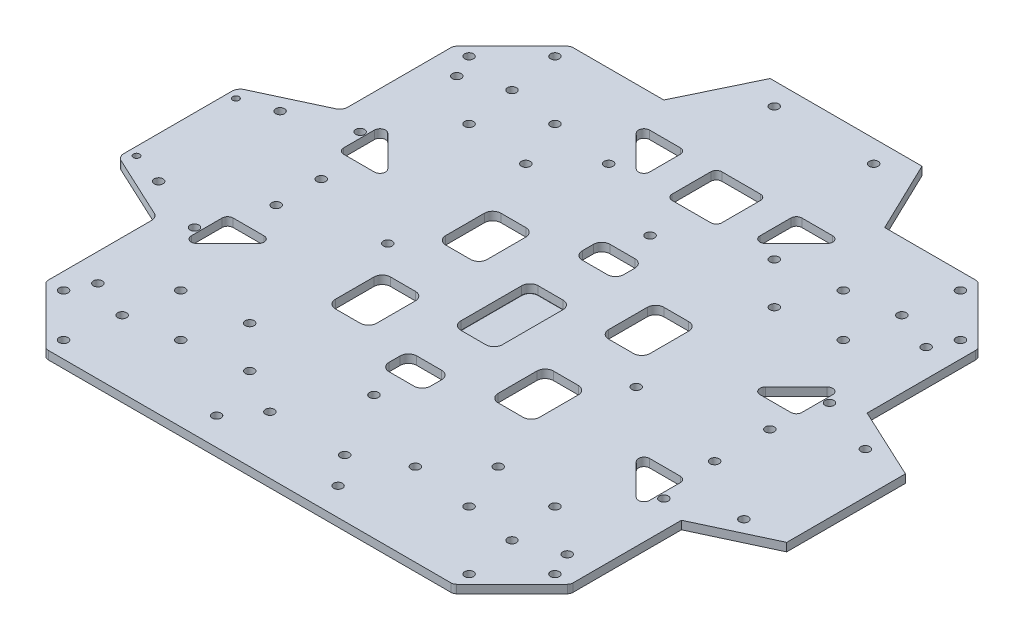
SolidWorks part; units mm, degrees
ref_plane "前视基准面" through (0, 0, 0) normal (0, 0, 1) x (1, 0, 0)
ref_plane "上视基准面" through (0, 0, 0) normal (0, 1, 0) x (1, 0, 0)
ref_plane "右视基准面" through (0, 0, 0) normal (1, 0, 0) x (0, 0, -1)
other "Configuration Table"
sketch "草图1" plane through (0, 0, 0) normal (0, 1, 0) x (1, 0, 0)
  line L0 (0, 0) -> (0, 165.603) construction
  line L1 (95, -73.7868) -> (95, 73.7868)
  line L2 (95, 73.7868) -> (73.7868, 95)
  line L3 (73.7868, 95) -> (-73.7868, 95)
  line L4 (-73.7868, 95) -> (-95, 73.7868)
  line L5 (-95, 73.7868) -> (-95, -73.7868)
  line L6 (-95, -73.7868) -> (-73.7868, -95)
  line L7 (-73.7868, -95) -> (73.7868, -95)
  line L8 (73.7868, -95) -> (95, -73.7868)
  line L9 (0, 0) -> (213.7391, 0) construction
  line L10 (-88.9896, -73.4332) -> (-52.22, -67.7764) construction
  line L11 (-73.4332, -88.9896) -> (-67.7764, -52.22) construction
  circle A0 centre (-88.9896, -73.4332) radius 1.6
  circle A1 centre (-73.4332, -88.9896) radius 1.6
  circle A2 centre (-73.4332, 88.9896) radius 1.6
  circle A3 centre (-88.9896, 73.4332) radius 1.6
  circle A4 centre (73.4332, 88.9896) radius 1.6
  circle A5 centre (88.9896, 73.4332) radius 1.6
  circle A6 centre (88.9896, -73.4332) radius 1.6
  circle A7 centre (73.4332, -88.9896) radius 1.6
  circle A9 centre (-67.7764, -52.22) radius 1.6
  circle A10 centre (-52.22, -67.7764) radius 1.6
  circle A11 centre (67.7764, -52.22) radius 1.6
  circle A12 centre (52.22, -67.7764) radius 1.6
  circle A13 centre (67.7764, 52.22) radius 1.6
  circle A14 centre (52.22, 67.7764) radius 1.6
  circle A15 centre (-67.7764, 52.22) radius 1.6
  circle A16 centre (-52.22, 67.7764) radius 1.6
  circle A17 centre (-70.6048, -70.6048) radius 1.6
  circle A18 centre (-70.6048, 70.6048) radius 1.6
  circle A19 centre (70.6048, -70.6048) radius 1.6
  circle A20 centre (70.6048, 70.6048) radius 1.6
  dimension "D5" = 3.2
  dimension "D6" = 3.2
  dimension "D7" = 3.2
  dimension "D1" = 190
  dimension "D2" = 190
  dimension "D3" = 30
  dimension "D4" = 135
extrude "凸台-拉伸1" add sketch "草图1" along normal blind 3 contours L8 A7 A6 L1 L2 A5 A4 L3 L4 A2 A3 L5 L6 A0 A1 L7 A15 A14 A13 A11 A10 A9 A12 A16
fillet "圆角1" radius 2 8 edges at (95, 1.5, -73.7868) (95, 1.5, 73.7868) (73.7868, 1.5, 95) (-73.7868, 1.5, 95) (-95, 1.5, -73.7868) (-73.7868, 1.5, -95) (73.7868, 1.5, -95) (-95, 1.5, 73.7868)
sketch "草图2" plane through (0, 3, 0) normal (0, 1, 0) x (1, 0, 0)
  line L0 (0, 95) -> (0, -95) construction
  line L1 (72.9584, 95) -> (-72.9584, 95) construction
  line L2 (-72.9584, -95) -> (72.9584, -95) construction
  line L3 (-20, -65) -> (-38, -83) construction
  line L4 (-38, -83) -> (-20, -83) construction
  line L5 (-20, -83) -> (-20, -65) construction
  line L6 (38, -83) -> (20, -83) construction
  line L7 (20, -65) -> (38, -83) construction
  line L8 (20, -83) -> (20, -65) construction
  line L9 (-65, 20) -> (-83, 38)
  line L10 (-9, -83) -> (9, -83) construction
  line L11 (-9, -83) -> (-9, -65) construction
  line L12 (-9, -65) -> (9, -65) construction
  line L13 (9, -83) -> (9, -65) construction
  line L14 (-83, 38) -> (-83, 20)
  line L15 (-83, 20) -> (-65, 20)
  line L16 (-83, -38) -> (-83, -20)
  line L17 (-65, -20) -> (-83, -38)
  line L18 (-83, -20) -> (-65, -20)
  line L19 (-83, 9) -> (-83, -9) construction
  line L20 (-83, 9) -> (-65, 9) construction
  line L21 (-65, 9) -> (-65, -9) construction
  line L22 (-83, -9) -> (-65, -9) construction
  line L23 (20, 65) -> (38, 83)
  line L24 (38, 83) -> (20, 83)
  line L25 (20, 83) -> (20, 65)
  line L26 (-38, 83) -> (-20, 83)
  line L27 (-20, 65) -> (-38, 83)
  line L28 (-20, 83) -> (-20, 65)
  line L29 (9, 83) -> (-9, 83)
  line L30 (9, 83) -> (9, 65)
  line L31 (9, 65) -> (-9, 65)
  line L32 (-9, 83) -> (-9, 65)
  line L33 (65, -20) -> (83, -38)
  line L34 (83, -38) -> (83, -20)
  line L35 (83, -20) -> (65, -20)
  line L36 (83, 38) -> (83, 20)
  line L37 (65, 20) -> (83, 38)
  line L38 (83, 20) -> (65, 20)
  line L39 (83, -9) -> (83, 9) construction
  line L40 (83, -9) -> (65, -9) construction
  line L41 (65, -9) -> (65, 9) construction
  line L42 (83, 9) -> (65, 9) construction
  point P49 (0, 0)
  dimension "D1" = 20
  dimension "D2" = 18
  dimension "D3" = 12
  dimension "D4" = 11
  dimension "D5" = 4
extrude "切除-拉伸1" cut sketch "草图2" against normal through all
fillet "圆角2" radius 2 22 edges at (38, 1.5, -83) (20, 1.5, -65) (20, 1.5, -83) (-20, 1.5, -83) (-20, 1.5, -65) (-38, 1.5, -83) (-9, 1.5, -65) (-9, 1.5, -83) (9, 1.5, -83) (9, 1.5, -65) (-83, 1.5, 20) (-65, 1.5, 20) (-83, 1.5, -38) (-65, 1.5, -20) (-83, 1.5, -20) (83, 1.5, -20) (65, 1.5, -20) (83, 1.5, -38) (83, 1.5, 38) (65, 1.5, 20) (83, 1.5, 20) (-83, 1.5, 38)
sketch "草图4" plane through (0, 3, 0) normal (0, 1, 0) x (1, 0, 0)
  line L0 (0, 0) -> (0, 123) construction
  line L1 (72.9584, 95) -> (-72.9584, 95) construction
  line L2 (-21.5, 121) -> (-33.624, 95) construction
  line L3 (-21.5, 95) -> (21.5, 95) construction
  line L5 (-21.5, 121) -> (21.5, 121) construction
  line L7 (-33.624, 95) -> (-21.5, 95) construction
  line L8 (21.5, 121) -> (33.624, 95) construction
  line L9 (33.624, 95) -> (21.5, 95) construction
  line L16 (21.5, -121) -> (33.624, -95) construction
  line L17 (21.5, -95) -> (-21.5, -95) construction
  line L18 (21.5, -121) -> (-21.5, -121) construction
  line L19 (33.624, -95) -> (21.5, -95) construction
  line L20 (-21.5, -121) -> (-33.624, -95) construction
  line L21 (-33.624, -95) -> (-21.5, -95) construction
  line L22 (-121, -21.5) -> (-95, -33.624)
  line L23 (-95, -21.5) -> (-95, 21.5)
  line L24 (-121, -21.5) -> (-121, 21.5)
  line L25 (-95, -33.624) -> (-95, -21.5)
  line L26 (-121, 21.5) -> (-95, 33.624)
  line L27 (-95, 33.624) -> (-95, 21.5)
  line L28 (121, 21.5) -> (95, 33.624)
  line L29 (95, 21.5) -> (95, -21.5)
  line L30 (121, 21.5) -> (121, -21.5)
  line L31 (95, 33.624) -> (95, 21.5)
  line L32 (121, -21.5) -> (95, -33.624)
  line L33 (95, -33.624) -> (95, -21.5)
  line L34 (95, 33.624) -> (95, 21.5)
  line L36 (121, 21.5) -> (95, 33.624)
  line L37 (95, -33.624) -> (95, -21.5)
  line L38 (121, -21.5) -> (121, 21.5)
  line L39 (95, -21.5) -> (95, 21.5)
  line L40 (121, -21.5) -> (95, -33.624)
  point P32 (0, 0)
  dimension "D1" = 28
  dimension "D2" = 43
  dimension "D3" = 26
  dimension "D4" = 65
  dimension "D5" = 26
  dimension "D6" = 4
extrude "凸台-拉伸2" add sketch "草图4" against normal up to surface (3 mm away)
fillet "圆角3" radius 3 4 edges at (-121, 1.5, -21.5) (-121, 1.5, 21.5) (-95, 1.5, 33.624) (-95, 1.5, -33.624)
sketch "草图5" plane through (0, 0, 0) normal (0, -1, 0) x (1, 0, 0)
  line L0 (0, -121) -> (0, 0) construction
  line L3 (-21, -121) -> (21, -121) construction
  line L4 (-21, -121) -> (-21, -79) construction
  line L5 (-21, -79) -> (21, -79) construction
  line L6 (21, -121) -> (21, -79) construction
  line L46 (77.5, 0) -> (-77.5, 0) construction
  line L47 (-37, -10) -> (-22, -10)
  line L48 (-77.25, 8.16) -> (-46.75, 8.16) construction
  line L65 (-77.25, 8.16) -> (-77.25, -8.16) construction
  line L66 (-77.25, -8.16) -> (-46.75, -8.16) construction
  line L67 (-46.75, 8.16) -> (-46.75, -8.16) construction
  line L68 (-7.5, -14) -> (7.5, -14)
  line L69 (-62, 9) -> (-62, -9) construction
  line L71 (72.9584, -95) -> (-72.9584, -95) construction
  line L72 (-7.5, -14) -> (-7.5, 14)
  line L73 (-7.5, 14) -> (7.5, 14)
  line L74 (7.5, -14) -> (7.5, 14)
  line L75 (-7.5, -14) -> (7.5, 14) construction
  line L76 (-7.5, 14) -> (7.5, -14) construction
  line L77 (-37, 30) -> (-22, 30)
  line L78 (-37, 30) -> (-37, 10)
  line L79 (-37, 10) -> (-22, 10)
  line L80 (-22, 30) -> (-22, 10)
  line L81 (-22, -30) -> (-22, -10)
  line L82 (-37, -30) -> (-22, -30)
  line L83 (-37, -30) -> (-37, -10)
  line L84 (37, 10) -> (22, 10)
  line L85 (22, 30) -> (22, 10)
  line L86 (37, 30) -> (22, 30)
  line L87 (37, 30) -> (37, 10)
  line L88 (37, -30) -> (37, -10)
  line L89 (37, -30) -> (22, -30)
  line L90 (22, -30) -> (22, -10)
  line L91 (37, -10) -> (22, -10)
  line L92 (-7.5, -40) -> (7.5, -40)
  line L93 (-7.5, 30) -> (7.5, 30)
  line L94 (-7.5, 30) -> (-7.5, 40)
  line L95 (-7.5, 40) -> (7.5, 40)
  line L96 (7.5, 30) -> (7.5, 40)
  line L97 (-7.5, 30) -> (7.5, 40) construction
  line L98 (-7.5, 40) -> (7.5, 30) construction
  line L99 (7.5, -30) -> (7.5, -40)
  line L100 (-7.5, -30) -> (7.5, -30)
  line L101 (-7.5, -30) -> (-7.5, -40)
  line L102 (0, 95) -> (0, 52.1919) construction
  line L103 (-72.9584, 95) -> (72.9584, 95) construction
  line L104 (13.55, 74.15) -> (-13.55, 74.15) construction
  circle A0 centre (-10.8959, -82.5) radius 1.6 construction
  circle A1 centre (9.1041, -82.5) radius 1.6 construction
  circle A2 centre (22, -106) radius 1.6 construction
  circle A3 centre (-22, -106) radius 1.6 construction
  circle A60 centre (-106, 22) radius 1.6
  circle A61 centre (-82.5, 10.8959) radius 1.6 construction
  circle A62 centre (-82.5, -9.1041) radius 1.6 construction
  circle A63 centre (-106, -22) radius 1.6
  circle A64 centre (22, 106) radius 1.6 construction
  circle A65 centre (10.8959, 82.5) radius 1.6 construction
  circle A66 centre (-9.1041, 82.5) radius 1.6 construction
  circle A67 centre (-22, 106) radius 1.6 construction
  circle A68 centre (106, -22) radius 1.6
  circle A69 centre (82.5, -10.8959) radius 1.6 construction
  circle A70 centre (82.5, 9.1041) radius 1.6 construction
  circle A71 centre (106, 22) radius 1.6
  circle A72 centre (-82.5, 10.8959) radius 1.6 construction
  circle A73 centre (-82.5, -9.1041) radius 1.6 construction
  circle A74 centre (10.8959, 82.5) radius 1.6 construction
  circle A75 centre (-9.1041, 82.5) radius 1.6 construction
  circle A76 centre (82.5, -10.8959) radius 1.6
  circle A77 centre (82.5, 9.1041) radius 1.6
  circle A78 centre (-77.25, 8.16) radius 1.6
  circle A79 centre (-46.75, 8.16) radius 1.6 construction
  circle A80 centre (-46.75, -8.16) radius 1.6 construction
  circle A81 centre (-77.25, -8.16) radius 1.6
  circle A82 centre (13.55, 74.15) radius 1.6
  circle A83 centre (-13.55, 74.15) radius 1.6
  point P2 (0, 74.15)
  point P32 (0, 35)
  point P156 (0, 0)
  point P169 (0, 0)
  dimension "D1" = 3.2
  dimension "D5" = 15
  dimension "D6" = 3.2
  dimension "D10" = 3.2
  dimension "D11" = 3.2
  dimension "D2" = 42
  dimension "D3" = 42
  dimension "D4" = 22
  dimension "D9" = 30.5
  dimension "D12" = 15
  dimension "D13" = 28
  dimension "D14" = 15
  dimension "D15" = 20
  dimension "D16" = 22
  dimension "D17" = 10
  dimension "D18" = 16
  dimension "D19" = 10
  dimension "D20" = 15
  dimension "D21" = 18
  dimension "D22" = 62
  dimension "D23" = 16.32
  dimension "D24" = 26
  dimension "D25" = 27.1
  dimension "D26" = 20.85
  dimension "D7" = 4
  dimension "D8" = 4
extrude "切除-拉伸3" cut sketch "草图5" against normal blind 10
fillet "圆角4" radius 3 28 edges at (-7.5, 1.5, -30) (7.5, 1.5, -30) (7.5, 1.5, -40) (-7.5, 1.5, -40) (22, 1.5, -30) (22, 1.5, -10) (37, 1.5, -10) (37, 1.5, -30) (7.5, 1.5, -14) (-7.5, 1.5, -14) (-7.5, 1.5, 14) (7.5, 1.5, 14) (7.5, 1.5, 30) (-7.5, 1.5, 30) (-7.5, 1.5, 40) (7.5, 1.5, 40) (-22, 1.5, 30) (-22, 1.5, 10) (-37, 1.5, 10) (-37, 1.5, -10) (-22, 1.5, -10) (-22, 1.5, -30) (-37, 1.5, -30) (37, 1.5, 10) (22, 1.5, 10) (22, 1.5, 30) (37, 1.5, 30) (-37, 1.5, 30)
sketch "草图6" plane through (0, 0, 0) normal (0, -1, 0) x (1, 0, 0)
  line L0 (-118, 18) -> (-118, -18) construction
  line L2 (-121, 0) -> (-102.1382, 0) construction
  line L4 (-121, 19.5888) -> (-121, -19.5888) construction
  circle A0 centre (-118, 18) radius 1.15
  circle A1 centre (-118, -18) radius 1.15
  point P7 (-118, 0)
  dimension "D2" = 2.3
  dimension "D1" = 36
  dimension "D3" = 3
extrude "激光安装孔" cut sketch "草图6" against normal blind 10
sketch "草图7" plane through (0, 3, 0) normal (0, 1, 0) x (1, 0, 0)
  line L0 (-40, 95) -> (-27.5, 121)
  line L1 (72.9584, 95) -> (-72.9584, 95) construction
  line L2 (-27.5, 121) -> (27.5, 121)
  line L3 (27.5, 121) -> (40, 95)
  line L4 (-40, 95) -> (40, 95)
  line L5 (0, 0) -> (0, 95) construction
  line L6 (0, 95) -> (0, 121) construction
  line L7 (18, 113) -> (-18, 113) construction
  circle A0 centre (18, 113) radius 1.6
  circle A1 centre (-18, 113) radius 1.6
  dimension "D5" = 3.2
  dimension "D1" = 80
  dimension "D2" = 55
  dimension "D3" = 26
  dimension "D4" = 36
  dimension "D6" = 8
extrude "凸台-拉伸3" add sketch "草图7" against normal up to surface (3 mm away)
sketch "草图8" plane through (0, 0, 0) normal (0, -1, 0) x (1, 0, 0)
  line L0 (0, 95) -> (0, 33.0191) construction
  line L2 (22, 85) -> (-22, 85) construction
  line L3 (-72.9584, 95) -> (72.9584, 95) construction
  circle A0 centre (22, 85) radius 1.6
  circle A1 centre (-22, 85) radius 1.6
  point P7 (0, 85)
  dimension "D1" = 44
  dimension "D2" = 3.2
  dimension "D3" = 10
extrude "切除-拉伸4" cut sketch "草图8" against normal blind 40
sketch "草图9" plane through (0, 0, 0) normal (0, -1, 0) x (1, 0, 0)
  line L1 (-45, 50) -> (45, 50) construction
  line L2 (-45, 50) -> (-45, -50) construction
  line L3 (-45, -50) -> (45, -50) construction
  line L4 (45, 50) -> (45, -50) construction
  line L5 (-45, 50) -> (45, -50) construction
  line L6 (-45, -50) -> (45, 50) construction
  circle A0 centre (-45, -50) radius 1.6
  circle A1 centre (45, -50) radius 1.6
  circle A2 centre (0, -50) radius 1.6
  circle A3 centre (-45, 0) radius 1.6
  circle A4 centre (-45, 50) radius 1.6
  circle A5 centre (0, 50) radius 1.6
  circle A6 centre (45, 50) radius 1.6
  circle A8 centre (45, 0) radius 1.6
  circle A9 centre (85, 65) radius 1.6 construction
  circle A10 centre (85, 65) radius 1.6
  circle A11 centre (-85, 65) radius 1.6 construction
  circle A12 centre (-85, 65) radius 1.6
  circle A13 centre (-85, -65) radius 1.6 construction
  circle A14 centre (-85, -65) radius 1.6
  circle A15 centre (85, -65) radius 1.6 construction
  circle A16 centre (85, -65) radius 1.6
  circle A17 centre (30, -65) radius 1.6 construction
  circle A18 centre (30, -65) radius 1.6
  circle A19 centre (-30, -65) radius 1.6 construction
  circle A20 centre (-30, -65) radius 1.6
  circle A21 centre (30, 65) radius 1.6 construction
  circle A22 centre (30, 65) radius 1.6
  circle A23 centre (-30, 65) radius 1.6 construction
  circle A24 centre (-30, 65) radius 1.6
  circle A25 centre (85, 30) radius 1.6 construction
  circle A26 centre (85, 30) radius 1.6
  circle A27 centre (85, -30) radius 1.6 construction
  circle A28 centre (85, -30) radius 1.6
  circle A29 centre (-85, -30) radius 1.6 construction
  circle A30 centre (-85, -30) radius 1.6
  circle A31 centre (-85, 30) radius 1.6 construction
  circle A32 centre (-85, 30) radius 1.6
  point P0 (0, 0)
  dimension "D3" = 3.2
  dimension "D1" = 90
  dimension "D2" = 100
extrude "切除-拉伸5" cut sketch "草图9" against normal blind 10
sketch "草图10" plane through (0, 0, 0) normal (0, -1, 0) x (1, 0, 0)
  line L0 (4.5, 13.9) -> (-4.5, 13.9)
  line L1 (-7.4, 11) -> (-7.4, -11)
  line L2 (-4.5, -13.9) -> (4.5, -13.9)
  line L3 (7.4, -11) -> (7.4, 11)
  line L4 (4.5, 14) -> (-4.5, 14)
  line L5 (7.5, -11) -> (7.5, 11)
  line L6 (-4.5, -14) -> (4.5, -14)
  line L7 (-7.5, 11) -> (-7.5, -11)
  line L8 (4.5, 14) -> (-4.5, 14)
  line L9 (7.5, -11) -> (7.5, 11)
  line L10 (-4.5, -14) -> (4.5, -14)
  line L11 (-7.5, 11) -> (-7.5, -11)
  arc A0 (-4.5, 13.9) -> (-7.4, 11) centre (-4.5, 11) ccw
  arc A1 (-7.4, -11) -> (-4.5, -13.9) centre (-4.5, -11) ccw
  arc A2 (4.5, -13.9) -> (7.4, -11) centre (4.5, -11) ccw
  arc A3 (7.4, 11) -> (4.5, 13.9) centre (4.5, 11) ccw
  arc A4 (7.5, 11) -> (4.5, 14) centre (4.5, 11) ccw
  arc A5 (4.5, -14) -> (7.5, -11) centre (4.5, -11) ccw
  arc A6 (-7.5, -11) -> (-4.5, -14) centre (-4.5, -11) ccw
  arc A7 (-4.5, 14) -> (-7.5, 11) centre (-4.5, 11) ccw
  arc A8 (7.5, 11) -> (4.5, 14) centre (4.5, 11) ccw
  arc A9 (4.5, -14) -> (7.5, -11) centre (4.5, -11) ccw
  arc A10 (-7.5, -11) -> (-4.5, -14) centre (-4.5, -11) ccw
  arc A11 (-4.5, 14) -> (-7.5, 11) centre (-4.5, 11) ccw
  dimension "D1" = 0
  dimension "D2" = 0.1
extrude "凸台-拉伸4" add sketch "草图10" along normal blind 3 separate body contours L3 A3 L0 A0 L1 A1 L2 A2
sketch "草图11" plane through (0, -3, 0) normal (0, -1, 0) x (1, 0, 0)
  line L1 (-12.5, 17.5) -> (12.5, 17.5)
  line L2 (-12.5, 17.5) -> (-12.5, -17.5)
  line L3 (-12.5, -17.5) -> (12.5, -17.5)
  line L4 (12.5, 17.5) -> (12.5, -17.5)
  line L5 (-12.5, 17.5) -> (12.5, -17.5) construction
  line L6 (-12.5, -17.5) -> (12.5, 17.5) construction
  point P0 (0, 0)
  dimension "D1" = 25
  dimension "D2" = 35
extrude "凸台-拉伸5" add sketch "草图11" along normal blind 3
fillet "圆角5" radius 3 4 edges at (12.5, -4.5, 17.5) (-12.5, -4.5, 17.5) (12.5, -4.5, -17.5) (-12.5, -4.5, -17.5)
